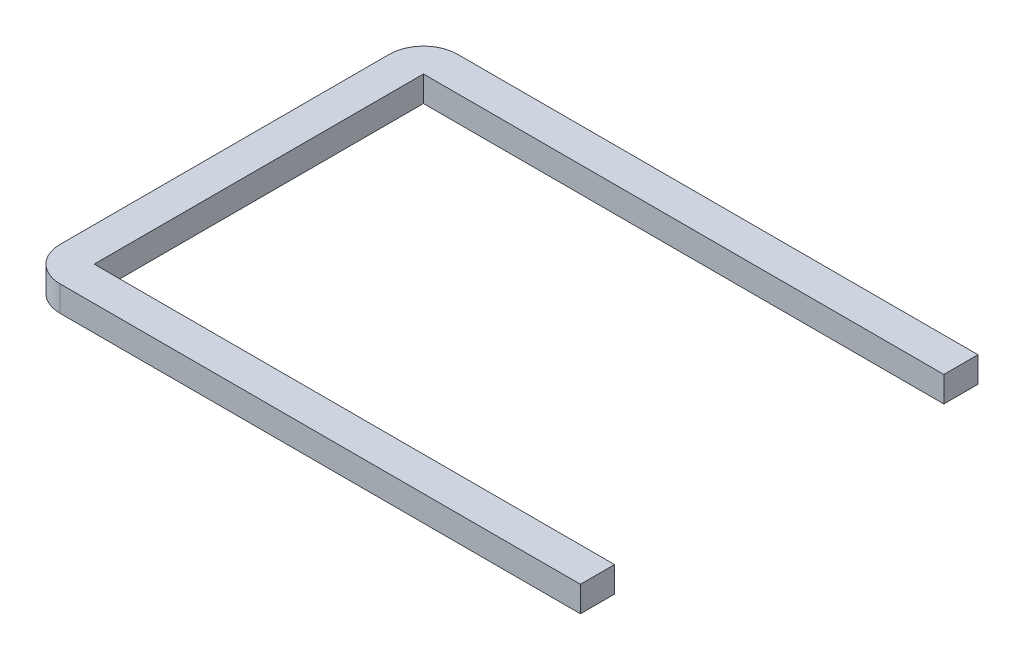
SolidWorks part; units mm, degrees
ref_plane "Front Plane" through (0, 0, 0) normal (0, 0, 1) x (1, 0, 0)
ref_plane "Top Plane" through (0, 0, 0) normal (0, 1, 0) x (1, 0, 0)
ref_plane "Right Plane" through (0, 0, 0) normal (1, 0, 0) x (0, 0, -1)
sketch "Sketch2" plane through (0, 0, 0) normal (0, 1, 0) x (1, 0, 0)
  line L0 (0, 0) -> (0, 116.5)
  line L1 (0, 116.5) -> (162.5, 116.5)
  line L2 (0, 0) -> (162.5, 0)
  dimension "D1" = 162.5
  dimension "D2" = 116.5
extrude "Extrude-Thin1" add sketch "Sketch2" along normal blind 7.5 thin
fillet "Fillet1" radius 10 2 edges at (0, 3.75, -116.5) (0, 3.75, 0)
sketch "Sketch3" plane through (0, 0, 0) normal (0, -1, 0) x (1, 0, 0)
  line L0 (0, -106.5) -> (0, -10) construction
  line L1 (72.5, -2.5) -> (122.5, -2.5)
  line L2 (72.5, -2.5) -> (72.5, -7.5)
  line L3 (72.5, -7.5) -> (122.5, -7.5)
  line L4 (122.5, -2.5) -> (122.5, -7.5)
  line L5 (2.5, -33.25) -> (7.5, -33.25)
  line L6 (2.5, -33.25) -> (2.5, -83.25)
  line L7 (2.5, -83.25) -> (7.5, -83.25)
  line L8 (7.5, -33.25) -> (7.5, -83.25)
  line L9 (72.5, -109) -> (122.5, -109)
  line L10 (72.5, -109) -> (72.5, -114)
  line L11 (72.5, -114) -> (122.5, -114)
  line L12 (122.5, -109) -> (122.5, -114)
  line L13 (162.5, -10) -> (162.5, 0) construction
  line L14 (45.8105, 0) -> (45.8105, -10) construction
  line L15 (10, 0) -> (162.5, 0) construction
  line L16 (10, -10) -> (162.5, -10) construction
  line L17 (45.8105, -106.5) -> (45.8105, -116.5) construction
  line L18 (162.5, -106.5) -> (10, -106.5) construction
  line L19 (162.5, -116.5) -> (10, -116.5) construction
  line L20 (0, -94.4098) -> (10, -94.4098) construction
  line L21 (10, -106.5) -> (10, -10) construction
  point P30 (5, -83.25)
  point P31 (5, -94.4098)
  point P32 (45.8105, -111.5)
  point P33 (72.5, -111.5)
  point P34 (45.8105, -5)
  point P35 (72.5, -5)
  point P36 (10, -58.25)
  point P37 (7.5, -58.25)
  dimension "D1" = 40
  dimension "D2" = 50
  dimension "D3" = 5
sketch "Sketch4" plane through (0, 7.5, 0) normal (0, 1, 0) x (1, 0, 0)
  line L0 (162.5, 10) -> (82.5, 10) construction
  line L1 (10, 10) -> (162.5, 10) construction
  line L2 (162.5, 10) -> (197.5, 10) construction
  line L3 (82.5, 20.6986) -> (197.5, 20.6986) construction
  line L4 (140, 20.6986) -> (140, 10) construction
  line L5 (82.5, 5) -> (82.5, 10) construction
  line L7 (192.5, 10) -> (87.5, 10) construction
  line L8 (162.5, 10) -> (162.5, 0) construction
  line L10 (77.5, 10) -> (202.5, 10)
  line L11 (87.5, 10) -> (192.5, 10)
  arc A1 (82.5, 5) -> (80, 7.5) centre (82.5, 7.5) cw
  arc A2 (85, 7.5) -> (82.5, 5) centre (82.5, 7.5) cw
  arc A3 (80, 7.5) -> (77.5, 10) centre (77.5, 7.5) ccw
  arc A4 (195, 7.5) -> (197.5, 5) centre (197.5, 7.5) ccw
  arc A5 (197.5, 5) -> (200, 7.5) centre (197.5, 7.5) ccw
  arc A6 (200, 7.5) -> (202.5, 10) centre (202.5, 7.5) cw
  arc A7 (85, 7.5) -> (87.5, 10) centre (87.5, 7.5) cw
  arc A8 (195, 7.5) -> (192.5, 10) centre (192.5, 7.5) ccw
  point P22 (140, 10)
  point P23 (162.5, 5)
  point P40 (140, 10)
  dimension "D1" = 80
  dimension "D2" = 35
  dimension "D3" = 115
extrude "Cut-Extrude1" [suppressed] cut sketch "Sketch4" against normal through all contours A2 A7 L10 A3 A1 | A8 A4 A5 A6 L10
extrude "Cut-Extrude2" cut sketch "Sketch3" against normal blind 2.1 draft 45
